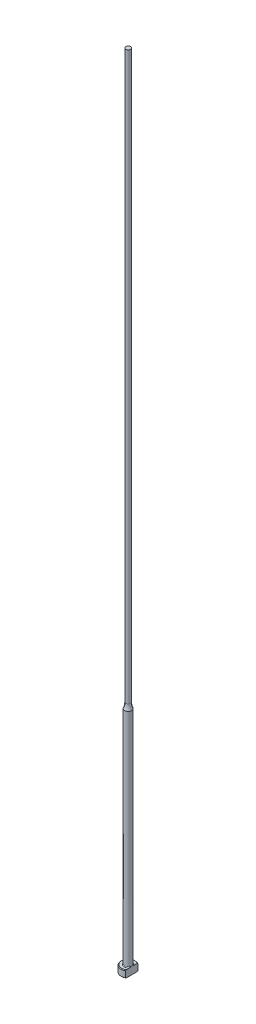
SolidWorks part; units mm, degrees
ref_plane "Front Plane" through (0, 0, 0) normal (0, 0, 1) x (1, 0, 0)
ref_plane "Top Plane" through (0, 0, 0) normal (0, 1, 0) x (1, 0, 0)
ref_plane "Right Plane" through (0, 0, 0) normal (1, 0, 0) x (0, 0, -1)
sketch "Sketch1" plane through (0, 0, 0) normal (0, 0, 1) x (1, 0, 0)
  line L0 (0, 259.9588) -> (0, -15.1925) construction
  line L1 (0, 0) -> (-3.175, 0)
  line L2 (-3.175, 0) -> (-3.175, 3.175)
  line L3 (-3.175, 3.175) -> (-1.5875, 3.175)
  line L4 (-1.0554, 104.1446) -> (-1.0554, 355.6)
  line L5 (-1.0554, 355.6) -> (0, 355.6)
  line L6 (0, 355.6) -> (0, 0)
  line L7 (-1.5875, 3.175) -> (-1.5875, 101.6)
  arc A0 (-1.5875, 101.6) -> (-1.0554, 104.1446) centre (-7.4054, 104.1446) ccw
  point P13 (-1.5875, 0)
  dimension "D1" = 6.35
  dimension "L" = 355.6
  dimension "D2" = 3.175
  dimension "H" = 6.35
  dimension "T" = 3.175
  dimension "D" = 2.1107
  dimension "S" = 101.6
revolve "Revolve1" add sketch "Sketch1" angle 360 about L0
chamfer "Chamfer1" distance 0.254 angle 45 2 edges at (0, 3.175, 3.175) (0, 0, 3.175)
fillet "Fillet1" radius 0.254 1 edges at (0, 3.175, 1.5875)
sketch "Sketch2" plane through (0, 0, 0) normal (0, 1, 0) x (1, 0, 0)
  line L0 (1.5875, -2.7496) -> (1.5875, 2.7496)
  circle A0 centre (0, 0) radius 3.175 construction
  arc A2 (1.5875, -2.7496) -> (1.5875, 2.7496) centre (0, 0) ccw
  circle A3 centre (0, 0) radius 3.175 construction
  circle A4 centre (0, 0) radius 1.5875 construction
extrude "Key Head" cut sketch "Sketch2" along normal up to next
